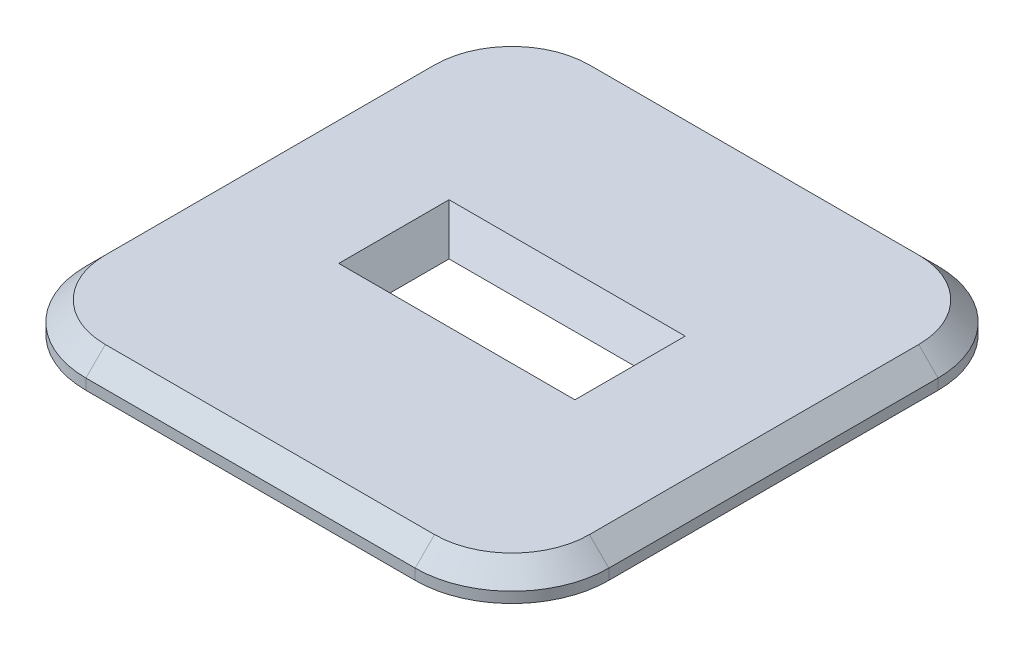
SolidWorks part; units mm, degrees
ref_plane "Front Plane" through (0, 0, 0) normal (0, 0, 1) x (1, 0, 0)
ref_plane "Top Plane" through (0, 0, 0) normal (0, 1, 0) x (1, 0, 0)
ref_plane "Right Plane" through (0, 0, 0) normal (1, 0, 0) x (0, 0, -1)
sketch "Sketch1" plane through (0, 0, 0) normal (0, 1, 0) x (1, 0, 0)
  line L1 (2.7, 2.7) -> (-2.7, 2.7)
  line L2 (2.7, 2.7) -> (2.7, -2.7)
  line L3 (2.7, -2.7) -> (-2.7, -2.7)
  line L4 (-2.7, 2.7) -> (-2.7, -2.7)
  line L5 (2.7, 2.7) -> (-2.7, -2.7) construction
  line L6 (2.7, -2.7) -> (-2.7, 2.7) construction
  point P0 (0, 0)
  dimension "D1" = 5.4
  dimension "D2" = 5.4
extrude "Boss-Extrude1" add sketch "Sketch1" along normal blind 0.31
fillet "Fillet1" radius 1 4 edges at (-2.7, 0.155, -2.7) (2.7, 0.155, -2.7) (2.7, 0.155, 2.7) (-2.7, 0.155, 2.7)
chamfer "Chamfer1" distance 0.2 angle 45 8 edges at (2.4071, 0.31, 2.4071) (0, 0.31, 2.7) (-2.4071, 0.31, 2.4071) (-2.7, 0.31, 0) (-2.4071, 0.31, -2.4071) (0, 0.31, -2.7) (2.4071, 0.31, -2.4071) (2.7, 0.31, 0)
sketch "Sketch2" plane through (0, 0.31, 0) normal (0, 1, 0) x (1, 0, 0)
  line L1 (1, 0.35) -> (-1, 0.35)
  line L2 (1, 0.35) -> (1, -0.35)
  line L3 (1, -0.35) -> (-1, -0.35)
  line L4 (-1, 0.35) -> (-1, -0.35)
  line L5 (1, 0.35) -> (-1, -0.35) construction
  line L6 (1, -0.35) -> (-1, 0.35) construction
  point P0 (0, 0)
  dimension "D1" = 2
  dimension "D2" = 0.7
extrude "Cut-Extrude1" cut sketch "Sketch2" against normal through all
chamfer "Chamfer2" distance 0.31 angle 35.3 4 edges at (1, 0.31, 0) (0, 0.31, 0.35) (-1, 0.31, 0) (0, 0.31, -0.35)
